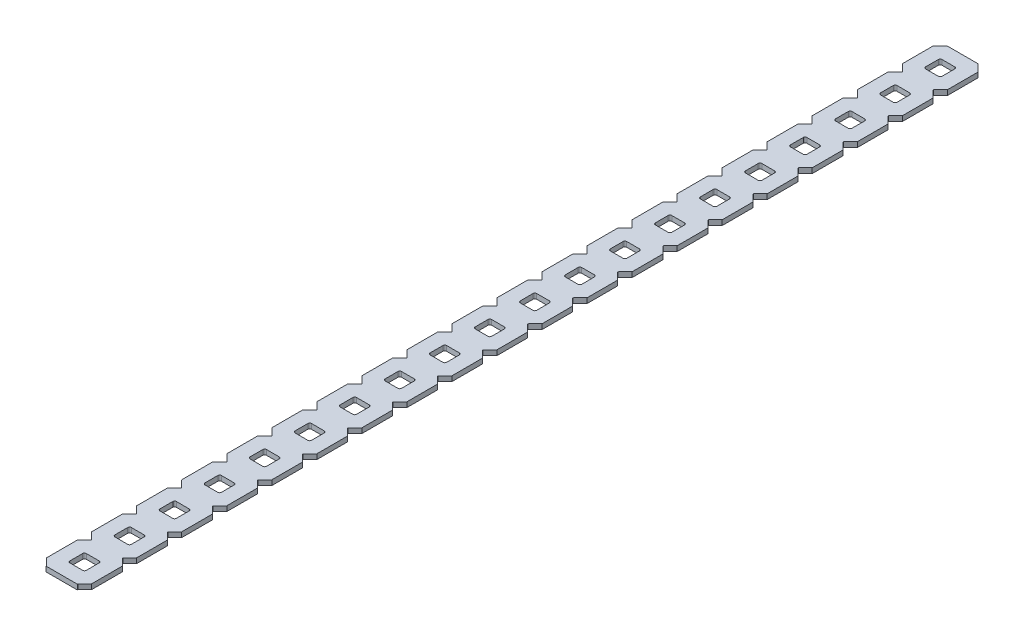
SolidWorks part; units mm, degrees
ref_plane "Front Plane" through (0, 0, 0) normal (0, 0, 1) x (1, 0, 0)
ref_plane "Top Plane" through (0, 0, 0) normal (0, 1, 0) x (1, 0, 0)
ref_plane "Right Plane" through (0, 0, 0) normal (1, 0, 0) x (0, 0, -1)
ref_plane "Plane1" through (0, 0, 0) normal (0, -1, 0) x (1, 0, 0)
sketch "Sketch1" plane through (0, 0, 0) normal (0, -1, 0) x (1, 0, 0)
  line L0 (4.5466, -308.8386) -> (8.1534, -308.8386)
  line L1 (8.6614, -309.3466) -> (8.6614, -312.9534)
  line L2 (8.1534, -313.4614) -> (4.5466, -313.4614)
  line L3 (4.0386, -312.9534) -> (4.0386, -309.3466)
  line L4 (4.5466, -296.1386) -> (8.1534, -296.1386)
  line L5 (8.6614, -296.6466) -> (8.6614, -300.2534)
  line L6 (8.1534, -300.7614) -> (4.5466, -300.7614)
  line L7 (4.0386, -300.2534) -> (4.0386, -296.6466)
  line L8 (4.5466, -283.4386) -> (8.1534, -283.4386)
  line L9 (8.6614, -283.9466) -> (8.6614, -287.5534)
  line L10 (8.1534, -288.0614) -> (4.5466, -288.0614)
  line L11 (4.0386, -287.5534) -> (4.0386, -283.9466)
  line L12 (4.5466, -270.7386) -> (8.1534, -270.7386)
  line L13 (8.6614, -271.2466) -> (8.6614, -274.8534)
  line L14 (8.1534, -275.3614) -> (4.5466, -275.3614)
  line L15 (4.0386, -274.8534) -> (4.0386, -271.2466)
  line L16 (4.5466, -258.0386) -> (8.1534, -258.0386)
  line L17 (8.6614, -258.5466) -> (8.6614, -262.1534)
  line L18 (8.1534, -262.6614) -> (4.5466, -262.6614)
  line L19 (4.0386, -262.1534) -> (4.0386, -258.5466)
  line L20 (4.5466, -245.3386) -> (8.1534, -245.3386)
  line L21 (8.6614, -245.8466) -> (8.6614, -249.4534)
  line L22 (8.1534, -249.9614) -> (4.5466, -249.9614)
  line L23 (4.0386, -249.4534) -> (4.0386, -245.8466)
  line L24 (4.5466, -232.6386) -> (8.1534, -232.6386)
  line L25 (8.6614, -233.1466) -> (8.6614, -236.7534)
  line L26 (8.1534, -237.2614) -> (4.5466, -237.2614)
  line L27 (4.0386, -236.7534) -> (4.0386, -233.1466)
  line L28 (4.5466, -219.9386) -> (8.1534, -219.9386)
  line L29 (8.6614, -220.4466) -> (8.6614, -224.0534)
  line L30 (8.1534, -224.5614) -> (4.5466, -224.5614)
  line L31 (4.0386, -224.0534) -> (4.0386, -220.4466)
  line L32 (4.5466, -207.2386) -> (8.1534, -207.2386)
  line L33 (8.6614, -207.7466) -> (8.6614, -211.3534)
  line L34 (8.1534, -211.8614) -> (4.5466, -211.8614)
  line L35 (4.0386, -211.3534) -> (4.0386, -207.7466)
  line L36 (4.5466, -194.5386) -> (8.1534, -194.5386)
  line L37 (8.6614, -195.0466) -> (8.6614, -198.6534)
  line L38 (8.1534, -199.1614) -> (4.5466, -199.1614)
  line L39 (4.0386, -198.6534) -> (4.0386, -195.0466)
  line L40 (4.5466, -181.8386) -> (8.1534, -181.8386)
  line L41 (8.6614, -182.3466) -> (8.6614, -185.9534)
  line L42 (8.1534, -186.4614) -> (4.5466, -186.4614)
  line L43 (4.0386, -185.9534) -> (4.0386, -182.3466)
  line L44 (4.5466, -169.1386) -> (8.1534, -169.1386)
  line L45 (8.6614, -169.6466) -> (8.6614, -173.2534)
  line L46 (8.1534, -173.7614) -> (4.5466, -173.7614)
  line L47 (4.0386, -173.2534) -> (4.0386, -169.6466)
  line L48 (4.5466, -156.4386) -> (8.1534, -156.4386)
  line L49 (8.6614, -156.9466) -> (8.6614, -160.5534)
  line L50 (8.1534, -161.0614) -> (4.5466, -161.0614)
  line L51 (4.0386, -160.5534) -> (4.0386, -156.9466)
  line L52 (4.5466, -143.7386) -> (8.1534, -143.7386)
  line L53 (8.6614, -144.2466) -> (8.6614, -147.8534)
  line L54 (8.1534, -148.3614) -> (4.5466, -148.3614)
  line L55 (4.0386, -147.8534) -> (4.0386, -144.2466)
  line L56 (4.5466, -131.0386) -> (8.1534, -131.0386)
  line L57 (8.6614, -131.5466) -> (8.6614, -135.1534)
  line L58 (8.1534, -135.6614) -> (4.5466, -135.6614)
  line L59 (4.0386, -135.1534) -> (4.0386, -131.5466)
  line L60 (4.5466, -118.3386) -> (8.1534, -118.3386)
  line L61 (8.6614, -118.8466) -> (8.6614, -122.4534)
  line L62 (8.1534, -122.9614) -> (4.5466, -122.9614)
  line L63 (4.0386, -122.4534) -> (4.0386, -118.8466)
  line L64 (4.5466, -105.6386) -> (8.1534, -105.6386)
  line L65 (8.6614, -106.1466) -> (8.6614, -109.7534)
  line L66 (8.1534, -110.2614) -> (4.5466, -110.2614)
  line L67 (4.0386, -109.7534) -> (4.0386, -106.1466)
  line L68 (4.5466, -92.9386) -> (8.1534, -92.9386)
  line L69 (8.6614, -93.4466) -> (8.6614, -97.0534)
  line L70 (8.1534, -97.5614) -> (4.5466, -97.5614)
  line L71 (4.0386, -97.0534) -> (4.0386, -93.4466)
  line L72 (4.5466, -80.2386) -> (8.1534, -80.2386)
  line L73 (8.6614, -80.7466) -> (8.6614, -84.3534)
  line L74 (8.1534, -84.8614) -> (4.5466, -84.8614)
  line L75 (4.0386, -84.3534) -> (4.0386, -80.7466)
  line L76 (4.5466, -67.5386) -> (8.1534, -67.5386)
  line L77 (8.6614, -68.0466) -> (8.6614, -71.6534)
  line L78 (8.1534, -72.1614) -> (4.5466, -72.1614)
  line L79 (4.0386, -71.6534) -> (4.0386, -68.0466)
  line L80 (4.5466, -54.8386) -> (8.1534, -54.8386)
  line L81 (8.6614, -55.3466) -> (8.6614, -58.9534)
  line L82 (8.1534, -59.4614) -> (4.5466, -59.4614)
  line L83 (4.0386, -58.9534) -> (4.0386, -55.3466)
  line L84 (4.5466, -42.1386) -> (8.1534, -42.1386)
  line L85 (8.6614, -42.6466) -> (8.6614, -46.2534)
  line L86 (8.1534, -46.7614) -> (4.5466, -46.7614)
  line L87 (4.0386, -46.2534) -> (4.0386, -42.6466)
  line L88 (4.5466, -29.4386) -> (8.1534, -29.4386)
  line L89 (8.6614, -29.9466) -> (8.6614, -33.5534)
  line L90 (8.1534, -34.0614) -> (4.5466, -34.0614)
  line L91 (4.0386, -33.5534) -> (4.0386, -29.9466)
  line L92 (12.7, -302.773) -> (12.7, -294.127)
  line L93 (12.7, -294.127) -> (10.7628, -292.1898)
  line L94 (10.7628, -292.0102) -> (12.7, -290.073)
  line L95 (12.7, -290.073) -> (12.7, -281.427)
  line L96 (12.7, -281.427) -> (10.7628, -279.4898)
  line L97 (10.7628, -279.3102) -> (12.7, -277.373)
  line L98 (12.7, -277.373) -> (12.7, -268.727)
  line L99 (12.7, -268.727) -> (10.7628, -266.7898)
  line L100 (10.7628, -266.6102) -> (12.7, -264.673)
  line L101 (12.7, -264.673) -> (12.7, -256.027)
  line L102 (12.7, -256.027) -> (10.7628, -254.0898)
  line L103 (10.7628, -253.9102) -> (12.7, -251.973)
  line L104 (12.7, -251.973) -> (12.7, -243.327)
  line L105 (12.7, -243.327) -> (10.7628, -241.3898)
  line L106 (10.7628, -241.2102) -> (12.7, -239.273)
  line L107 (12.7, -239.273) -> (12.7, -230.627)
  line L108 (12.7, -230.627) -> (10.7628, -228.6898)
  line L109 (10.7628, -228.5102) -> (12.7, -226.573)
  line L110 (12.7, -226.573) -> (12.7, -217.927)
  line L111 (12.7, -217.927) -> (10.7628, -215.9898)
  line L112 (10.7628, -215.8102) -> (12.7, -213.873)
  line L113 (12.7, -213.873) -> (12.7, -205.227)
  line L114 (12.7, -205.227) -> (10.7628, -203.2898)
  line L115 (10.7628, -203.1102) -> (12.7, -201.173)
  line L116 (12.7, -201.173) -> (12.7, -192.527)
  line L117 (12.7, -192.527) -> (10.7628, -190.5898)
  line L118 (10.7628, -190.4102) -> (12.7, -188.473)
  line L119 (12.7, -188.473) -> (12.7, -179.827)
  line L120 (12.7, -179.827) -> (10.7628, -177.8898)
  line L121 (10.7628, -177.7102) -> (12.7, -175.773)
  line L122 (12.7, -175.773) -> (12.7, -167.127)
  line L123 (12.7, -167.127) -> (10.7628, -165.1898)
  line L124 (10.7628, -165.0102) -> (12.7, -163.073)
  line L125 (12.7, -163.073) -> (12.7, -154.427)
  line L126 (12.7, -154.427) -> (10.7628, -152.4898)
  line L127 (10.7628, -152.3102) -> (12.7, -150.373)
  line L128 (12.7, -150.373) -> (12.7, -141.727)
  line L129 (12.7, -141.727) -> (10.7628, -139.7898)
  line L130 (10.7628, -139.6102) -> (12.7, -137.673)
  line L131 (12.7, -137.673) -> (12.7, -129.027)
  line L132 (12.7, -129.027) -> (10.7628, -127.0898)
  line L133 (10.7628, -126.9102) -> (12.7, -124.973)
  line L134 (12.7, -124.973) -> (12.7, -116.327)
  line L135 (12.7, -116.327) -> (10.7628, -114.3898)
  line L136 (10.7628, -114.2102) -> (12.7, -112.273)
  line L137 (12.7, -112.273) -> (12.7, -103.627)
  line L138 (12.7, -103.627) -> (10.7628, -101.6898)
  line L139 (10.7628, -101.5102) -> (12.7, -99.573)
  line L140 (12.7, -99.573) -> (12.7, -90.927)
  line L141 (12.7, -90.927) -> (10.7628, -88.9898)
  line L142 (10.7628, -88.8102) -> (12.7, -86.873)
  line L143 (12.7, -86.873) -> (12.7, -78.227)
  line L144 (12.7, -78.227) -> (10.7628, -76.2898)
  line L145 (10.7628, -76.1102) -> (12.7, -74.173)
  line L146 (12.7, -74.173) -> (12.7, -65.527)
  line L147 (12.7, -65.527) -> (10.7628, -63.5898)
  line L148 (10.7628, -63.4102) -> (12.7, -61.473)
  line L149 (12.7, -61.473) -> (12.7, -52.827)
  line L150 (12.7, -52.827) -> (10.7628, -50.8898)
  line L151 (10.7628, -50.7102) -> (12.7, -48.773)
  line L152 (12.7, -48.773) -> (12.7, -40.127)
  line L153 (12.7, -40.127) -> (10.7628, -38.1898)
  line L154 (10.7628, -38.0102) -> (12.7, -36.073)
  line L155 (12.7, -36.073) -> (12.7, -27.427)
  line L156 (12.7, -27.427) -> (10.7628, -25.4898)
  line L157 (10.7628, -25.3102) -> (12.7, -23.373)
  line L158 (12.7, -23.373) -> (12.7, -14.727)
  line L159 (12.7, -14.727) -> (10.7628, -12.7898)
  line L160 (10.7628, -12.6102) -> (12.7, -10.673)
  line L161 (12.7, -10.673) -> (12.7, -2.032)
  line L162 (12.7, -2.032) -> (10.668, 0)
  line L163 (10.668, 0) -> (2.032, 0)
  line L164 (2.032, 0) -> (0, -2.032)
  line L165 (0, -2.032) -> (0, -10.673)
  line L166 (0, -10.673) -> (1.9372, -12.6102)
  line L167 (1.9372, -12.7898) -> (0, -14.727)
  line L168 (0, -14.727) -> (0, -23.373)
  line L169 (0, -23.373) -> (1.9372, -25.3102)
  line L170 (1.9372, -25.4898) -> (0, -27.427)
  line L171 (0, -27.427) -> (0, -36.073)
  line L172 (0, -36.073) -> (1.9372, -38.0102)
  line L173 (1.9372, -38.1898) -> (0, -40.127)
  line L174 (0, -40.127) -> (0, -48.773)
  line L175 (0, -48.773) -> (1.9372, -50.7102)
  line L176 (1.9372, -50.8898) -> (0, -52.827)
  line L177 (0, -52.827) -> (0, -61.473)
  line L178 (0, -61.473) -> (1.9372, -63.4102)
  line L179 (1.9372, -63.5898) -> (0, -65.527)
  line L180 (0, -65.527) -> (0, -74.173)
  line L181 (0, -74.173) -> (1.9372, -76.1102)
  line L182 (1.9372, -76.2898) -> (0, -78.227)
  line L183 (0, -78.227) -> (0, -86.873)
  line L184 (0, -86.873) -> (1.9372, -88.8102)
  line L185 (1.9372, -88.9898) -> (0, -90.927)
  line L186 (0, -90.927) -> (0, -99.573)
  line L187 (0, -99.573) -> (1.9372, -101.5102)
  line L188 (1.9372, -101.6898) -> (0, -103.627)
  line L189 (0, -103.627) -> (0, -112.273)
  line L190 (0, -112.273) -> (1.9372, -114.2102)
  line L191 (1.9372, -114.3898) -> (0, -116.327)
  line L192 (0, -116.327) -> (0, -124.973)
  line L193 (0, -124.973) -> (1.9372, -126.9102)
  line L194 (1.9372, -127.0898) -> (0, -129.027)
  line L195 (0, -129.027) -> (0, -137.673)
  line L196 (0, -137.673) -> (1.9372, -139.6102)
  line L197 (1.9372, -139.7898) -> (0, -141.727)
  line L198 (0, -141.727) -> (0, -150.373)
  line L199 (0, -150.373) -> (1.9372, -152.3102)
  line L200 (1.9372, -152.4898) -> (0, -154.427)
  line L201 (0, -154.427) -> (0, -163.073)
  line L202 (0, -163.073) -> (1.9372, -165.0102)
  line L203 (1.9372, -165.1898) -> (0, -167.127)
  line L204 (0, -167.127) -> (0, -175.773)
  line L205 (0, -175.773) -> (1.9372, -177.7102)
  line L206 (1.9372, -177.8898) -> (0, -179.827)
  line L207 (0, -179.827) -> (0, -188.473)
  line L208 (0, -188.473) -> (1.9372, -190.4102)
  line L209 (1.9372, -190.5898) -> (0, -192.527)
  line L210 (0, -192.527) -> (0, -201.173)
  line L211 (0, -201.173) -> (1.9372, -203.1102)
  line L212 (1.9372, -203.2898) -> (0, -205.227)
  line L213 (0, -205.227) -> (0, -213.873)
  line L214 (0, -213.873) -> (1.9372, -215.8102)
  line L215 (1.9372, -215.9898) -> (0, -217.927)
  line L216 (0, -217.927) -> (0, -226.573)
  line L217 (0, -226.573) -> (1.9372, -228.5102)
  line L218 (1.9372, -228.6898) -> (0, -230.627)
  line L219 (0, -230.627) -> (0, -239.273)
  line L220 (0, -239.273) -> (1.9372, -241.2102)
  line L221 (1.9372, -241.3898) -> (0, -243.327)
  line L222 (0, -243.327) -> (0, -251.973)
  line L223 (0, -251.973) -> (1.9372, -253.9102)
  line L224 (1.9372, -254.0898) -> (0, -256.027)
  line L225 (0, -256.027) -> (0, -264.673)
  line L226 (0, -264.673) -> (1.9372, -266.6102)
  line L227 (1.9372, -266.7898) -> (0, -268.727)
  line L228 (0, -268.727) -> (0, -277.373)
  line L229 (0, -277.373) -> (1.9372, -279.3102)
  line L230 (1.9372, -279.4898) -> (0, -281.427)
  line L231 (0, -281.427) -> (0, -290.073)
  line L232 (0, -290.073) -> (1.9372, -292.0102)
  line L233 (1.9372, -292.1898) -> (0, -294.127)
  line L234 (0, -294.127) -> (0, -302.773)
  line L235 (0, -302.773) -> (1.9372, -304.7102)
  line L236 (1.9372, -304.8898) -> (0, -306.827)
  line L237 (0, -306.827) -> (0, -315.468)
  line L238 (0, -315.468) -> (2.032, -317.5)
  line L239 (2.032, -317.5) -> (10.668, -317.5)
  line L240 (10.668, -317.5) -> (12.7, -315.468)
  line L241 (12.7, -315.468) -> (12.7, -306.827)
  line L242 (12.7, -306.827) -> (10.7628, -304.8898)
  line L243 (10.7628, -304.7102) -> (12.7, -302.773)
  line L244 (8.1534, -8.6614) -> (4.5466, -8.6614)
  line L245 (4.0386, -8.1534) -> (4.0386, -4.5466)
  line L246 (4.5466, -4.0386) -> (8.1534, -4.0386)
  line L247 (8.6614, -4.5466) -> (8.6614, -8.1534)
  line L248 (4.0386, -20.8534) -> (4.0386, -17.2466)
  line L249 (4.5466, -16.7386) -> (8.1534, -16.7386)
  line L250 (8.6614, -17.2466) -> (8.6614, -20.8534)
  line L251 (8.1534, -21.3614) -> (4.5466, -21.3614)
  arc A0 (4.0386, -309.3466) -> (4.5466, -308.8386) centre (4.5466, -309.3466) cw
  arc A1 (8.1534, -308.8386) -> (8.6614, -309.3466) centre (8.1534, -309.3466) cw
  arc A2 (8.6614, -312.9534) -> (8.1534, -313.4614) centre (8.1534, -312.9534) cw
  arc A3 (4.5466, -313.4614) -> (4.0386, -312.9534) centre (4.5466, -312.9534) cw
  arc A4 (4.0386, -296.6466) -> (4.5466, -296.1386) centre (4.5466, -296.6466) cw
  arc A5 (8.1534, -296.1386) -> (8.6614, -296.6466) centre (8.1534, -296.6466) cw
  arc A6 (8.6614, -300.2534) -> (8.1534, -300.7614) centre (8.1534, -300.2534) cw
  arc A7 (4.5466, -300.7614) -> (4.0386, -300.2534) centre (4.5466, -300.2534) cw
  arc A8 (4.0386, -283.9466) -> (4.5466, -283.4386) centre (4.5466, -283.9466) cw
  arc A9 (8.1534, -283.4386) -> (8.6614, -283.9466) centre (8.1534, -283.9466) cw
  arc A10 (8.6614, -287.5534) -> (8.1534, -288.0614) centre (8.1534, -287.5534) cw
  arc A11 (4.5466, -288.0614) -> (4.0386, -287.5534) centre (4.5466, -287.5534) cw
  arc A12 (4.0386, -271.2466) -> (4.5466, -270.7386) centre (4.5466, -271.2466) cw
  arc A13 (8.1534, -270.7386) -> (8.6614, -271.2466) centre (8.1534, -271.2466) cw
  arc A14 (8.6614, -274.8534) -> (8.1534, -275.3614) centre (8.1534, -274.8534) cw
  arc A15 (4.5466, -275.3614) -> (4.0386, -274.8534) centre (4.5466, -274.8534) cw
  arc A16 (4.0386, -258.5466) -> (4.5466, -258.0386) centre (4.5466, -258.5466) cw
  arc A17 (8.1534, -258.0386) -> (8.6614, -258.5466) centre (8.1534, -258.5466) cw
  arc A18 (8.6614, -262.1534) -> (8.1534, -262.6614) centre (8.1534, -262.1534) cw
  arc A19 (4.5466, -262.6614) -> (4.0386, -262.1534) centre (4.5466, -262.1534) cw
  arc A20 (4.0386, -245.8466) -> (4.5466, -245.3386) centre (4.5466, -245.8466) cw
  arc A21 (8.1534, -245.3386) -> (8.6614, -245.8466) centre (8.1534, -245.8466) cw
  arc A22 (8.6614, -249.4534) -> (8.1534, -249.9614) centre (8.1534, -249.4534) cw
  arc A23 (4.5466, -249.9614) -> (4.0386, -249.4534) centre (4.5466, -249.4534) cw
  arc A24 (4.0386, -233.1466) -> (4.5466, -232.6386) centre (4.5466, -233.1466) cw
  arc A25 (8.1534, -232.6386) -> (8.6614, -233.1466) centre (8.1534, -233.1466) cw
  arc A26 (8.6614, -236.7534) -> (8.1534, -237.2614) centre (8.1534, -236.7534) cw
  arc A27 (4.5466, -237.2614) -> (4.0386, -236.7534) centre (4.5466, -236.7534) cw
  arc A28 (4.0386, -220.4466) -> (4.5466, -219.9386) centre (4.5466, -220.4466) cw
  arc A29 (8.1534, -219.9386) -> (8.6614, -220.4466) centre (8.1534, -220.4466) cw
  arc A30 (8.6614, -224.0534) -> (8.1534, -224.5614) centre (8.1534, -224.0534) cw
  arc A31 (4.5466, -224.5614) -> (4.0386, -224.0534) centre (4.5466, -224.0534) cw
  arc A32 (4.0386, -207.7466) -> (4.5466, -207.2386) centre (4.5466, -207.7466) cw
  arc A33 (8.1534, -207.2386) -> (8.6614, -207.7466) centre (8.1534, -207.7466) cw
  arc A34 (8.6614, -211.3534) -> (8.1534, -211.8614) centre (8.1534, -211.3534) cw
  arc A35 (4.5466, -211.8614) -> (4.0386, -211.3534) centre (4.5466, -211.3534) cw
  arc A36 (4.0386, -195.0466) -> (4.5466, -194.5386) centre (4.5466, -195.0466) cw
  arc A37 (8.1534, -194.5386) -> (8.6614, -195.0466) centre (8.1534, -195.0466) cw
  arc A38 (8.6614, -198.6534) -> (8.1534, -199.1614) centre (8.1534, -198.6534) cw
  arc A39 (4.5466, -199.1614) -> (4.0386, -198.6534) centre (4.5466, -198.6534) cw
  arc A40 (4.0386, -182.3466) -> (4.5466, -181.8386) centre (4.5466, -182.3466) cw
  arc A41 (8.1534, -181.8386) -> (8.6614, -182.3466) centre (8.1534, -182.3466) cw
  arc A42 (8.6614, -185.9534) -> (8.1534, -186.4614) centre (8.1534, -185.9534) cw
  arc A43 (4.5466, -186.4614) -> (4.0386, -185.9534) centre (4.5466, -185.9534) cw
  arc A44 (4.0386, -169.6466) -> (4.5466, -169.1386) centre (4.5466, -169.6466) cw
  arc A45 (8.1534, -169.1386) -> (8.6614, -169.6466) centre (8.1534, -169.6466) cw
  arc A46 (8.6614, -173.2534) -> (8.1534, -173.7614) centre (8.1534, -173.2534) cw
  arc A47 (4.5466, -173.7614) -> (4.0386, -173.2534) centre (4.5466, -173.2534) cw
  arc A48 (4.0386, -156.9466) -> (4.5466, -156.4386) centre (4.5466, -156.9466) cw
  arc A49 (8.1534, -156.4386) -> (8.6614, -156.9466) centre (8.1534, -156.9466) cw
  arc A50 (8.6614, -160.5534) -> (8.1534, -161.0614) centre (8.1534, -160.5534) cw
  arc A51 (4.5466, -161.0614) -> (4.0386, -160.5534) centre (4.5466, -160.5534) cw
  arc A52 (4.0386, -144.2466) -> (4.5466, -143.7386) centre (4.5466, -144.2466) cw
  arc A53 (8.1534, -143.7386) -> (8.6614, -144.2466) centre (8.1534, -144.2466) cw
  arc A54 (8.6614, -147.8534) -> (8.1534, -148.3614) centre (8.1534, -147.8534) cw
  arc A55 (4.5466, -148.3614) -> (4.0386, -147.8534) centre (4.5466, -147.8534) cw
  arc A56 (4.0386, -131.5466) -> (4.5466, -131.0386) centre (4.5466, -131.5466) cw
  arc A57 (8.1534, -131.0386) -> (8.6614, -131.5466) centre (8.1534, -131.5466) cw
  arc A58 (8.6614, -135.1534) -> (8.1534, -135.6614) centre (8.1534, -135.1534) cw
  arc A59 (4.5466, -135.6614) -> (4.0386, -135.1534) centre (4.5466, -135.1534) cw
  arc A60 (4.0386, -118.8466) -> (4.5466, -118.3386) centre (4.5466, -118.8466) cw
  arc A61 (8.1534, -118.3386) -> (8.6614, -118.8466) centre (8.1534, -118.8466) cw
  arc A62 (8.6614, -122.4534) -> (8.1534, -122.9614) centre (8.1534, -122.4534) cw
  arc A63 (4.5466, -122.9614) -> (4.0386, -122.4534) centre (4.5466, -122.4534) cw
  arc A64 (4.0386, -106.1466) -> (4.5466, -105.6386) centre (4.5466, -106.1466) cw
  arc A65 (8.1534, -105.6386) -> (8.6614, -106.1466) centre (8.1534, -106.1466) cw
  arc A66 (8.6614, -109.7534) -> (8.1534, -110.2614) centre (8.1534, -109.7534) cw
  arc A67 (4.5466, -110.2614) -> (4.0386, -109.7534) centre (4.5466, -109.7534) cw
  arc A68 (4.0386, -93.4466) -> (4.5466, -92.9386) centre (4.5466, -93.4466) cw
  arc A69 (8.1534, -92.9386) -> (8.6614, -93.4466) centre (8.1534, -93.4466) cw
  arc A70 (8.6614, -97.0534) -> (8.1534, -97.5614) centre (8.1534, -97.0534) cw
  arc A71 (4.5466, -97.5614) -> (4.0386, -97.0534) centre (4.5466, -97.0534) cw
  arc A72 (4.0386, -80.7466) -> (4.5466, -80.2386) centre (4.5466, -80.7466) cw
  arc A73 (8.1534, -80.2386) -> (8.6614, -80.7466) centre (8.1534, -80.7466) cw
  arc A74 (8.6614, -84.3534) -> (8.1534, -84.8614) centre (8.1534, -84.3534) cw
  arc A75 (4.5466, -84.8614) -> (4.0386, -84.3534) centre (4.5466, -84.3534) cw
  arc A76 (4.0386, -68.0466) -> (4.5466, -67.5386) centre (4.5466, -68.0466) cw
  arc A77 (8.1534, -67.5386) -> (8.6614, -68.0466) centre (8.1534, -68.0466) cw
  arc A78 (8.6614, -71.6534) -> (8.1534, -72.1614) centre (8.1534, -71.6534) cw
  arc A79 (4.5466, -72.1614) -> (4.0386, -71.6534) centre (4.5466, -71.6534) cw
  arc A80 (4.0386, -55.3466) -> (4.5466, -54.8386) centre (4.5466, -55.3466) cw
  arc A81 (8.1534, -54.8386) -> (8.6614, -55.3466) centre (8.1534, -55.3466) cw
  arc A82 (8.6614, -58.9534) -> (8.1534, -59.4614) centre (8.1534, -58.9534) cw
  arc A83 (4.5466, -59.4614) -> (4.0386, -58.9534) centre (4.5466, -58.9534) cw
  arc A84 (4.0386, -42.6466) -> (4.5466, -42.1386) centre (4.5466, -42.6466) cw
  arc A85 (8.1534, -42.1386) -> (8.6614, -42.6466) centre (8.1534, -42.6466) cw
  arc A86 (8.6614, -46.2534) -> (8.1534, -46.7614) centre (8.1534, -46.2534) cw
  arc A87 (4.5466, -46.7614) -> (4.0386, -46.2534) centre (4.5466, -46.2534) cw
  arc A88 (4.0386, -29.9466) -> (4.5466, -29.4386) centre (4.5466, -29.9466) cw
  arc A89 (8.1534, -29.4386) -> (8.6614, -29.9466) centre (8.1534, -29.9466) cw
  arc A90 (8.6614, -33.5534) -> (8.1534, -34.0614) centre (8.1534, -33.5534) cw
  arc A91 (4.5466, -34.0614) -> (4.0386, -33.5534) centre (4.5466, -33.5534) cw
  arc A92 (10.7628, -292.1898) -> (10.7628, -292.0102) centre (10.8526, -292.1) cw
  arc A93 (10.7628, -279.4898) -> (10.7628, -279.3102) centre (10.8526, -279.4) cw
  arc A94 (10.7628, -266.7898) -> (10.7628, -266.6102) centre (10.8526, -266.7) cw
  arc A95 (10.7628, -254.0898) -> (10.7628, -253.9102) centre (10.8526, -254) cw
  arc A96 (10.7628, -241.3898) -> (10.7628, -241.2102) centre (10.8526, -241.3) cw
  arc A97 (10.7628, -228.6898) -> (10.7628, -228.5102) centre (10.8526, -228.6) cw
  arc A98 (10.7628, -215.9898) -> (10.7628, -215.8102) centre (10.8526, -215.9) cw
  arc A99 (10.7628, -203.2898) -> (10.7628, -203.1102) centre (10.8526, -203.2) cw
  arc A100 (10.7628, -190.5898) -> (10.7628, -190.4102) centre (10.8526, -190.5) cw
  arc A101 (10.7628, -177.8898) -> (10.7628, -177.7102) centre (10.8526, -177.8) cw
  arc A102 (10.7628, -165.1898) -> (10.7628, -165.0102) centre (10.8526, -165.1) cw
  arc A103 (10.7628, -152.4898) -> (10.7628, -152.3102) centre (10.8526, -152.4) cw
  arc A104 (10.7628, -139.7898) -> (10.7628, -139.6102) centre (10.8526, -139.7) cw
  arc A105 (10.7628, -127.0898) -> (10.7628, -126.9102) centre (10.8526, -127) cw
  arc A106 (10.7628, -114.3898) -> (10.7628, -114.2102) centre (10.8526, -114.3) cw
  arc A107 (10.7628, -101.6898) -> (10.7628, -101.5102) centre (10.8526, -101.6) cw
  arc A108 (10.7628, -88.9898) -> (10.7628, -88.8102) centre (10.8526, -88.9) cw
  arc A109 (10.7628, -76.2898) -> (10.7628, -76.1102) centre (10.8526, -76.2) cw
  arc A110 (10.7628, -63.5898) -> (10.7628, -63.4102) centre (10.8526, -63.5) cw
  arc A111 (10.7628, -50.8898) -> (10.7628, -50.7102) centre (10.8526, -50.8) cw
  arc A112 (10.7628, -38.1898) -> (10.7628, -38.0102) centre (10.8526, -38.1) cw
  arc A113 (10.7628, -25.4898) -> (10.7628, -25.3102) centre (10.8526, -25.4) cw
  arc A114 (10.7628, -12.7898) -> (10.7628, -12.6102) centre (10.8526, -12.7) cw
  arc A115 (1.9372, -12.6102) -> (1.9372, -12.7898) centre (1.8474, -12.7) cw
  arc A116 (1.9372, -25.3102) -> (1.9372, -25.4898) centre (1.8474, -25.4) cw
  arc A117 (1.9372, -38.0102) -> (1.9372, -38.1898) centre (1.8474, -38.1) cw
  arc A118 (1.9372, -50.7102) -> (1.9372, -50.8898) centre (1.8474, -50.8) cw
  arc A119 (1.9372, -63.4102) -> (1.9372, -63.5898) centre (1.8474, -63.5) cw
  arc A120 (1.9372, -76.1102) -> (1.9372, -76.2898) centre (1.8474, -76.2) cw
  arc A121 (1.9372, -88.8102) -> (1.9372, -88.9898) centre (1.8474, -88.9) cw
  arc A122 (1.9372, -101.5102) -> (1.9372, -101.6898) centre (1.8474, -101.6) cw
  arc A123 (1.9372, -114.2102) -> (1.9372, -114.3898) centre (1.8474, -114.3) cw
  arc A124 (1.9372, -126.9102) -> (1.9372, -127.0898) centre (1.8474, -127) cw
  arc A125 (1.9372, -139.6102) -> (1.9372, -139.7898) centre (1.8474, -139.7) cw
  arc A126 (1.9372, -152.3102) -> (1.9372, -152.4898) centre (1.8474, -152.4) cw
  arc A127 (1.9372, -165.0102) -> (1.9372, -165.1898) centre (1.8474, -165.1) cw
  arc A128 (1.9372, -177.7102) -> (1.9372, -177.8898) centre (1.8474, -177.8) cw
  arc A129 (1.9372, -190.4102) -> (1.9372, -190.5898) centre (1.8474, -190.5) cw
  arc A130 (1.9372, -203.1102) -> (1.9372, -203.2898) centre (1.8474, -203.2) cw
  arc A131 (1.9372, -215.8102) -> (1.9372, -215.9898) centre (1.8474, -215.9) cw
  arc A132 (1.9372, -228.5102) -> (1.9372, -228.6898) centre (1.8474, -228.6) cw
  arc A133 (1.9372, -241.2102) -> (1.9372, -241.3898) centre (1.8474, -241.3) cw
  arc A134 (1.9372, -253.9102) -> (1.9372, -254.0898) centre (1.8474, -254) cw
  arc A135 (1.9372, -266.6102) -> (1.9372, -266.7898) centre (1.8474, -266.7) cw
  arc A136 (1.9372, -279.3102) -> (1.9372, -279.4898) centre (1.8474, -279.4) cw
  arc A137 (1.9372, -292.0102) -> (1.9372, -292.1898) centre (1.8474, -292.1) cw
  arc A138 (1.9372, -304.7102) -> (1.9372, -304.8898) centre (1.8474, -304.8) cw
  arc A139 (10.7628, -304.8898) -> (10.7628, -304.7102) centre (10.8526, -304.8) cw
  arc A140 (8.6614, -8.1534) -> (8.1534, -8.6614) centre (8.1534, -8.1534) cw
  arc A141 (4.5466, -8.6614) -> (4.0386, -8.1534) centre (4.5466, -8.1534) cw
  arc A142 (4.0386, -4.5466) -> (4.5466, -4.0386) centre (4.5466, -4.5466) cw
  arc A143 (8.1534, -4.0386) -> (8.6614, -4.5466) centre (8.1534, -4.5466) cw
  arc A144 (4.0386, -17.2466) -> (4.5466, -16.7386) centre (4.5466, -17.2466) cw
  arc A145 (8.1534, -16.7386) -> (8.6614, -17.2466) centre (8.1534, -17.2466) cw
  arc A146 (8.6614, -20.8534) -> (8.1534, -21.3614) centre (8.1534, -20.8534) cw
  arc A147 (4.5466, -21.3614) -> (4.0386, -20.8534) centre (4.5466, -20.8534) cw
extrude "Boss-Extrude1" add sketch "Sketch1" against normal blind 1.4224
sketch "Sketch3" plane through (0, 1.4224, 0) normal (0, 1, 0) x (1, 0, 0)
  line L0 (12.7, 315.468) -> (12.7, 61.473)
  line L2 (13.6507, 63.4102) -> (-1.0669, 63.4102)
  line L3 (13.6507, 63.4102) -> (13.6507, -1.3386)
  line L4 (13.6507, -1.3386) -> (-1.0669, -1.3386)
  line L5 (-1.0669, 63.4102) -> (-1.0669, -1.3386)
extrude "Cut-Extrude1" cut sketch "Sketch3" against normal blind 2.54 contours L2 L5 L4 L3
